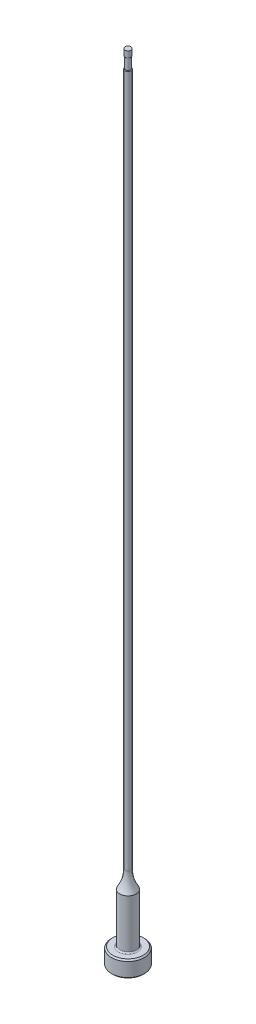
SolidWorks part; units mm, degrees
ref_plane "Front Plane" through (0, 0, 0) normal (0, 0, 1) x (1, 0, 0)
ref_plane "Top Plane" through (0, 0, 0) normal (0, 1, 0) x (1, 0, 0)
ref_plane "Right Plane" through (0, 0, 0) normal (1, 0, 0) x (0, 0, -1)
other "Configuration Table"
sketch "Sketch1" plane through (0, 0, 0) normal (0, 0, 1) x (1, 0, 0)
  line L0 (0, 259.9588) -> (0, -15.1925) construction
  line L1 (0, 0) -> (-3.175, 0)
  line L2 (-3.175, 0) -> (-3.175, 3.175)
  line L3 (-3.175, 3.175) -> (-1.5875, 3.175)
  line L4 (-0.5944, 16.1098) -> (-0.5944, 152.4)
  line L5 (-0.5944, 152.4) -> (0, 152.4)
  line L6 (0, 152.4) -> (0, 0)
  line L7 (-1.5875, 3.175) -> (-1.5875, 12.7)
  arc A1 (-1.5875, 12.7) -> (-0.5944, 16.1098) centre (-6.9444, 16.1098) ccw
  dimension "D1" = 6.35
  dimension "L" = 152.4
  dimension "D2" = 3.175
  dimension "H" = 6.35
  dimension "T" = 3.175
  dimension "D" = 1.1887
  dimension "S" = 12.7
revolve "Revolve1" add sketch "Sketch1" angle 360 about L0
chamfer "Chamfer1" distance 0.254 angle 45 2 edges at (0, 3.175, 3.175) (0, 0, 3.175)
fillet "Fillet1" radius 0.254 1 edges at (0, 3.175, 1.5875)
sketch "Sketch2" plane through (0, 0, 0) normal (0, 0, 1) x (1, 0, 0)
  line L0 (-0.5944, 152.4) -> (-0.5944, 16.1098) construction
  line L1 (-0.5944, 151.13) -> (-0.4928, 151.13)
  line L2 (-0.5944, 151.13) -> (-0.5944, 149.098)
  line L3 (-0.5944, 149.098) -> (-0.4928, 149.098)
  line L4 (-0.4928, 151.13) -> (-0.4928, 149.098)
  line L5 (0.5944, 152.4) -> (-0.5944, 152.4) construction
  line L6 (0, 153.4483) -> (0, 147.3282) construction
  dimension "D1" = 2.032
  dimension "N" = 1.27
  dimension "FD" = 0.1016
  dimension "D3" = 0.9855
revolve "Vent Relief" cut sketch "Sketch2" angle 360 about L6
sketch "Sketch3" plane through (0, 0, 0) normal (0, 0, 1) x (1, 0, 0)
  line L0 (-0.4928, 150.114) -> (-0.4928, 112.014)
  line L1 (-0.4928, 151.13) -> (-0.4928, 149.098) construction
  line L2 (-0.5944, 149.098) -> (-0.5944, 16.1098) construction
  line L3 (-0.5944, 111.2172) -> (-0.5944, 150.114)
  line L4 (-0.5944, 150.114) -> (-0.4928, 150.114)
  arc A0 (-0.4928, 112.014) -> (-0.5944, 111.2172) centre (-3.6678, 112.014) cw
  dimension "D1" = 3.175
  dimension "D2" = 38.1
extrude "D-Slot" cut sketch "Sketch3" against normal through all both and the other way through all
sketch "Sketch5" plane through (0, 0, 0) normal (0, 0, 1) x (1, 0, 0)
  line L0 (-0.5944, 151.13) -> (0.5944, 151.13) construction
  line L1 (-0.5944, 152.4) -> (-0.5753, 152.4)
  line L2 (-0.5944, 152.4) -> (-0.5944, 151.13)
  line L3 (-0.5944, 151.13) -> (-0.5753, 151.13)
  line L4 (-0.5753, 152.4) -> (-0.5753, 151.13)
  line L5 (0, 152.6877) -> (0, 150.5771) construction
  dimension "VP" = 0.019
revolve "Vent Diameter" cut sketch "Sketch5" angle 360 about L5
fillet "Fillet2" radius 0.127 2 edges at (0.5944, 149.098, 0) (0, 151.13, 0.5753)
sketch "Pocket Sketch" plane through (0, 0, 0) normal (0, 0, 1) x (1, 0, 0)
  line L0 (-3.5719, 0) -> (-3.5719, 3.2004)
  line L1 (-3.5719, 3.2004) -> (-1.5548, 3.2004)
  line L2 (-0.7928, 3.9624) -> (-0.7928, 22.225)
  line L3 (-0.7928, 22.225) -> (0, 22.225)
  line L4 (0, 22.225) -> (0, 0)
  line L5 (0, 0) -> (-3.5719, 0)
  line L6 (0, 12.6104) -> (0, -2.4989) construction
  line L7 (-3.175, 2.921) -> (-3.175, 0.254) construction
  line L8 (2.921, 3.175) -> (-2.921, 3.175) construction
  line L9 (-0.5944, 111.2172) -> (-0.5944, 16.1098) construction
  line L10 (-1.5548, 3.2004) -> (-0.7928, 3.9624)
  point P3 (-0.7928, 3.2004)
  dimension "D1" = 7.1437
  dimension "D2" = 0.3969
  dimension "D3" = 0.0254
  dimension "D4" = 0.1984
  dimension "D5" = 1.5856
  dimension "D6" = 22.225
